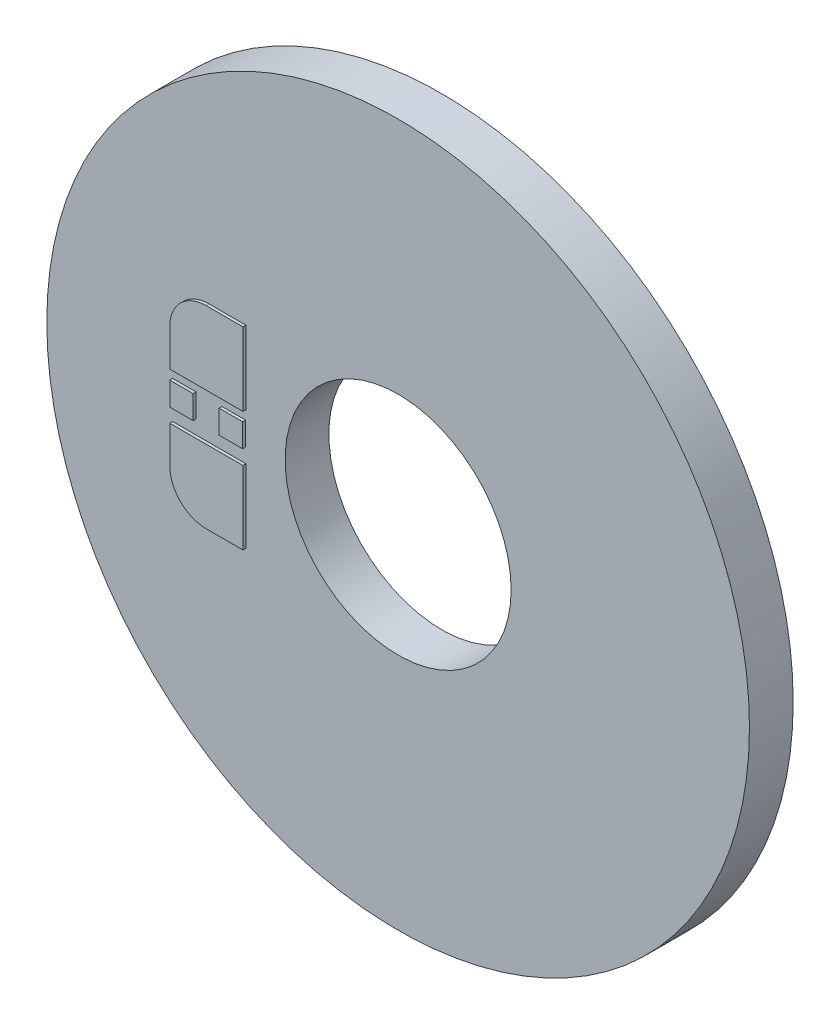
SolidWorks part; units mm, degrees
ref_plane "Front" through (0, 0, 0) normal (0, 0, 1) x (1, 0, 0)
ref_plane "Top" through (0, 0, 0) normal (0, 1, 0) x (1, 0, 0)
ref_plane "Right" through (0, 0, 0) normal (1, 0, 0) x (0, 0, -1)
sketch "Sketch1" plane through (0, 0, 0) normal (0, 0, 1) x (1, 0, 0)
  circle A2 centre (0, 0) radius 4.7625
  circle A3 centre (0, 0) radius 15.24
  dimension "D1" = 9.525
  dimension "D2" = 30.48
extrude "Extrude1" add sketch "Sketch1" along normal blind 1.8974
sketch "Sketch3" plane through (0, 0, 1.8974) normal (0, 0, 1) x (1, 0, 0)
  line L1 (-8.2042, 4.191) -> (-6.604, 4.191)
  line L2 (-9.779, 2.6162) -> (-9.779, 1.016)
  line L3 (-9.779, 1.016) -> (-6.604, 1.016)
  line L4 (-6.604, 4.191) -> (-6.604, 1.016)
  arc A0 (-9.779, 2.6162) -> (-8.2042, 4.191) centre (-8.2042, 2.6162) cw
  point P7 (-9.779, 4.191)
  dimension "D1" = 3.175
  dimension "D4" = 1.5748
  dimension "D2" = 1.016
  dimension "D3" = 6.604
extrude "Extrude3" add sketch "Sketch3" along normal blind 0.127
mirror "Mirror1" about plane through (0, 0, 0) normal (0, 1, 0) of "Extrude3"
sketch "Sketch4" plane through (0, 0, 0) normal (0, 0, 1) x (1, 0, 0)
  line L2 (15.0225, -2.5654) -> (17.272, -2.5654)
  line L5 (15.0225, -2.5654) -> (15.0225, 2.5654)
  line L6 (15.0225, 2.5654) -> (17.272, 2.5654)
  circle A0 centre (0, 0) radius 15.24 construction
  arc A2 (17.272, -2.5654) -> (17.272, 2.5654) centre (17.272, 0) ccw
  point P12 (15.0225, 0)
  dimension "D2" = 5.1308
  dimension "D3" = 2.5654
  dimension "D1" = 17.272
extrude "Extrude4" add sketch "Sketch4" along normal up to surface (1.8974 mm away)
hole_wizard "CSK for #2 Flat Head Machine Screw (100)1" positions "Sketch6" profile "Sketch5" countersink size "#2" standard "Ansi Inch"
sketch "Sketch6" plane through (0, 0, 0) normal (0, 0, -1) x (-1, 0, 0)
  arc A1 (-17.272, 2.5654) -> (-17.272, -2.5654) centre (-17.272, 0) ccw construction
  point P0 (-17.272, 0)
sketch "Sketch5" plane through (17.272, 0, 0) normal (1, 0, 0) x (0, 1, 0)
  line L0 (0, 0) -> (0, 133.1696)
  line L1 (0, 133.1696) -> (1.2192, 132.437)
  line L2 (1.2192, 132.437) -> (1.2192, 1.3733)
  line L3 (1.2192, 1.3733) -> (2.413, 0)
  line L5 (2.413, 0) -> (0, 0)
  line L6 (-1.2192, 1.3733) -> (-2.413, 0) construction
  line L10 (0, 133.1696) -> (-1.2192, 132.437) construction
  line L11 (0, -6.35) -> (0, 107.95) construction
  dimension "Hole Dia." = 2.4384
  dimension "Hole Depth" = 132.437
  dimension "Near C'Sink Dia." = 4.826
  dimension "Near C'Sink Angle" = 82
  dimension "Drill Angle" = 118
pattern_circular "CirPattern1" count 3 over 360 about axis through (0, 0, 0) along (0, 0, 1) of "Extrude4", "CSK for #2 Flat Head Machine Screw (100)1"
sketch "Sketch8" [suppressed] plane through (0, 0, 0) normal (0, 0, 1) x (1, 0, 0)
  circle A0 centre (0, 0) radius 19.8374 construction
  arc A2 (-6.4143, 16.2407) -> (-10.8577, 13.6753) centre (-8.636, 14.958) ccw construction
  dimension "D1" = 39.6748
fillet "Fillet2" [suppressed] radius 0.762
sketch "Sketch9" plane through (0, 0, 1.8974) normal (0, 0, 1) x (1, 0, 0)
  circle A0 centre (0, 0) radius 4.9022
  circle A1 centre (0, 0) radius 15.24
  dimension "D1" = 9.8044
  dimension "D2" = 30.48
extrude "Cut-Extrude1" cut sketch "Sketch9" against normal blind 2.54 and the other way blind 10 flip side to cut
sketch "Sketch10" plane through (0, 0, 2.0244) normal (0, 0, 1) x (1, 0, 0)
  line L0 (0, 0) -> (-14.7476, -3.8428) construction
  line L1 (-9.9915, -1.016) -> (-9.9915, -4.191) construction
  line L2 (-9.779, -1.016) -> (-6.604, -1.016) construction
  line L3 (-6.604, -4.191) -> (-8.2042, -4.191) construction
  circle A0 centre (-9.9915, -2.6035) radius 0.8509
  circle A1 centre (0, 0) radius 15.24 construction
  point P8 (-10.8149, -2.8181)
  dimension "D1" = 1.7018
  dimension "D2" = 4.064
extrude "Extrude5" [suppressed] add sketch "Sketch10" along normal blind 2.54
mirror "Mirror2" [suppressed] about plane through (0, 0, 0) normal (0, 1, 0)
fillet "Fillet3" [suppressed] radius 1.016
sketch "Sketch12" plane through (0, 0, 1.8974) normal (0, 0, 1) x (1, 0, 0)
  line L0 (-9.779, 2.6162) -> (-9.779, 1.016) construction
  line L1 (-9.779, 0.6034) -> (-8.763, 0.6034)
  line L2 (-9.779, 0.6034) -> (-9.779, -0.4126)
  line L3 (-9.779, -0.4126) -> (-8.763, -0.4126)
  line L4 (-8.763, 0.6034) -> (-8.763, -0.4126)
  line L6 (-6.621, 0.6185) -> (-7.637, 0.6185)
  line L7 (-6.621, 0.6185) -> (-6.621, -0.3975)
  line L8 (-6.621, -0.3975) -> (-7.637, -0.3975)
  line L9 (-7.637, 0.6185) -> (-7.637, -0.3975)
  line L10 (-9.779, 1.016) -> (-6.604, 1.016) construction
  line L11 (-9.779, -1.016) -> (-6.604, -1.016) construction
  dimension "D1" = 1.016
  dimension "D2" = 1.016
extrude "Extrude6" add sketch "Sketch12" along normal blind 0.127
